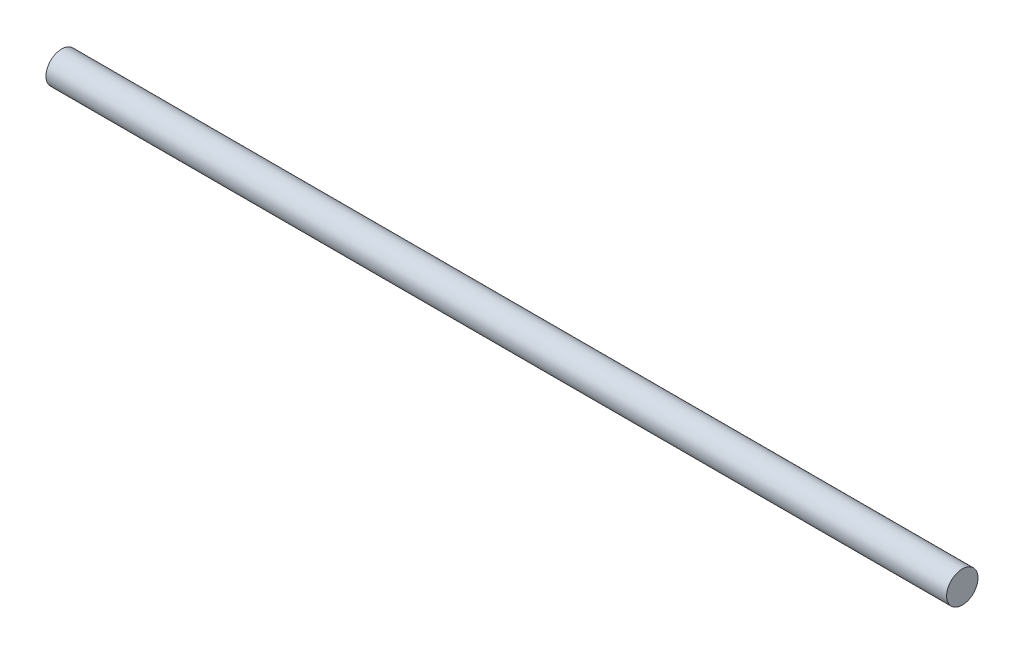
SolidWorks part; units mm, degrees
ref_plane "Front Plane" through (0, 0, 0) normal (0, 0, 1) x (1, 0, 0)
ref_plane "Top Plane" through (0, 0, 0) normal (0, 1, 0) x (1, 0, 0)
ref_plane "Right Plane" through (0, 0, 0) normal (1, 0, 0) x (0, 0, -1)
sketch "Sketch1" plane through (0, 0, 0) normal (0, 0, 1) x (1, 0, 0)
  line L0 (0, 0) -> (172.02, 0)
  dimension "D1" = 172.02
ref_plane "Plane1" through (0, 0, 0) normal (1, 0, 0) x (0, 0, -1)
sketch "Sketch2" plane through (0, 0, 0) normal (1, 0, 0) x (0, 0, -1)
  circle A0 centre (0, 0) radius 3
sweep "Sweep1" add profiles "Sketch2" path "Sketch1"
